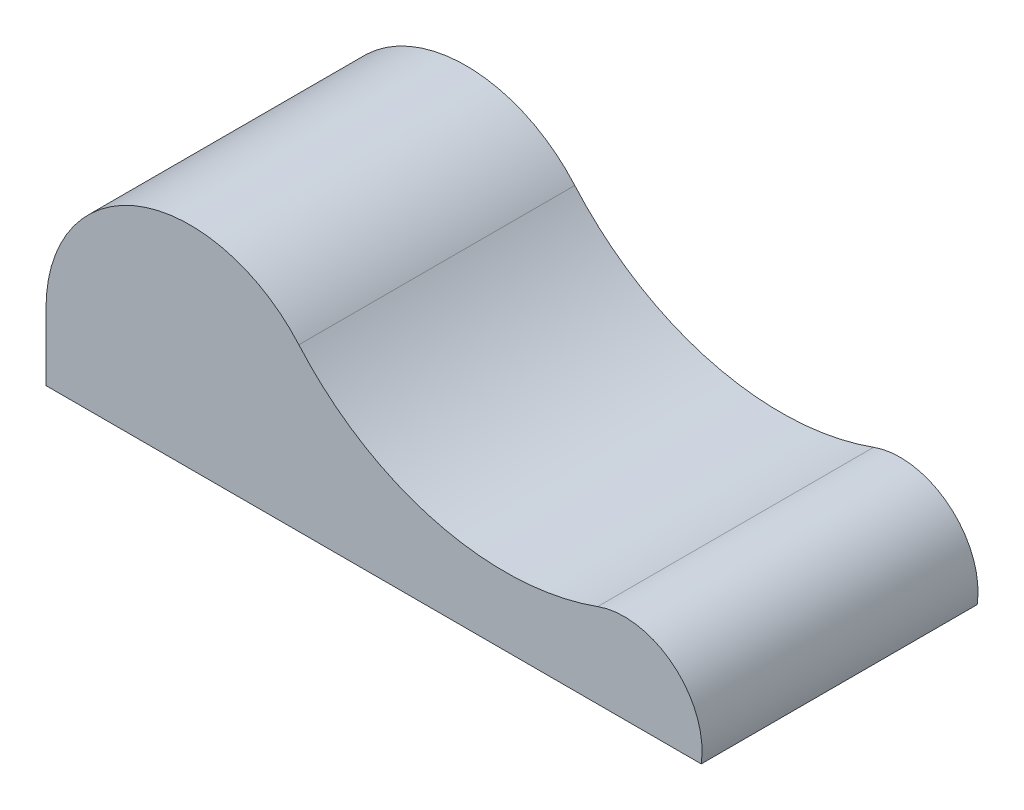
SolidWorks part; units mm, degrees
ref_plane "Front Plane" through (0, 0, 0) normal (0, 0, 1) x (1, 0, 0)
ref_plane "Top Plane" through (0, 0, 0) normal (0, 1, 0) x (1, 0, 0)
ref_plane "Right Plane" through (0, 0, 0) normal (1, 0, 0) x (0, 0, -1)
sketch "Sketch1" plane through (0, 0, 0) normal (0, 0, -1) x (-1, 0, 0)
  line L0 (-84.2973, 0) -> (84.2973, 0)
  line L1 (84.2973, 0) -> (84.2973, 17.2549)
  arc A0 (84.2973, 17.2549) -> (19.2387, 41.6326) centre (47.2008, 17.2549) ccw
  arc A1 (19.2387, 41.6326) -> (-57.6565, 21.7447) centre (-33.7225, 87.8046) cw
  arc A2 (-57.6565, 21.7447) -> (-84.2973, 0) centre (-64.4797, 2.9122) ccw
extrude "Extrude1" add sketch "Sketch1" against normal mid plane 71
